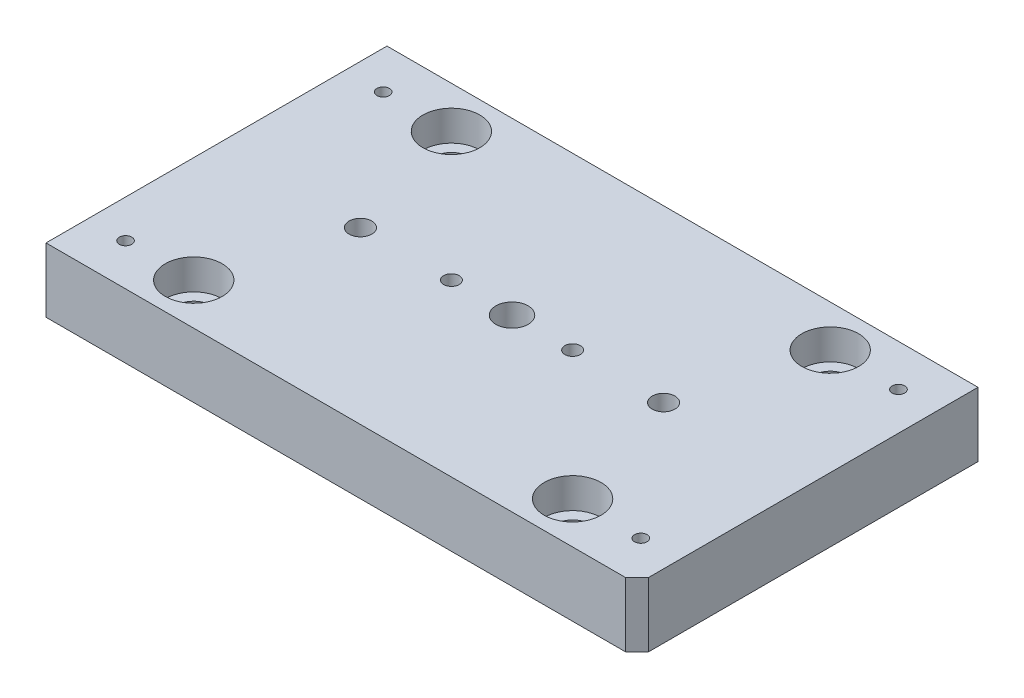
SolidWorks part; units mm, degrees
ref_plane "Plan de face" through (0, 0, 0) normal (0, 0, 1) x (1, 0, 0)
ref_plane "Plan de dessus" through (0, 0, 0) normal (0, 1, 0) x (1, 0, 0)
ref_plane "Plan de droite" through (0, 0, 0) normal (1, 0, 0) x (0, 0, -1)
sketch "Esquisse1" plane through (0, 0, 0) normal (0, 1, 0) x (1, 0, 0)
  line L1 (-78, 45) -> (78, 45)
  line L2 (-78, 45) -> (-78, -45)
  line L3 (-78, -45) -> (78, -45)
  line L4 (78, 45) -> (78, -45)
  point P4 (0, 45)
  point P6 (-78, 0)
  dimension "D1" = 156
  dimension "D2" = 90
extrude "Extrusion1" add sketch "Esquisse1" along normal blind 17
hole_wizard "Trou taraudé M4x0.71" positions "Esquisse3" profile "Esquisse2" tap size "M4x0.7" standard "Ansi Métrique"
sketch "Esquisse3" plane through (0, 17, 0) normal (0, 1, 0) x (-1, 0, 0)
  point P0 (-68, 34)
  point P1 (-68, -34)
  point P3 (68, -34)
  point P5 (68, 34)
  dimension "D1" = 34
  dimension "D2" = 68
  dimension "D3" = 136
  dimension "D4" = 68
sketch "Esquisse2" plane through (68, 17, 34) normal (1, 0, 0) x (0, 0, 1)
  line L0 (0, 0) -> (0, 11.0914)
  line L1 (0, 11.0914) -> (1.65, 10.1)
  line L2 (1.65, 10.1) -> (1.65, 0)
  line L5 (1.65, 0) -> (0, 0)
  line L10 (0, 11.0914) -> (-1.65, 10.1) construction
  line L11 (0, -6.35) -> (0, 107.95) construction
  dimension "Diamètre du trou pour taraudage" = 3.3
  dimension "Profondeur du trou pour taraudage" = 10.1
  dimension "Angle de pointe" = 118
hole_wizard "Chambrage pour vis à tête cylindrique à 6 pans creux (ou vis CHC) M81" positions "Esquisse5" profile "Esquisse4" counterbore size "M8" standard "Ansi Métrique"
sketch "Esquisse5" plane through (0, 17, 0) normal (0, 1, 0) x (-1, 0, 0)
  point P0 (-50, 34)
  point P1 (-50, -34)
  point P3 (50, -34)
  point P5 (50, 34)
  dimension "D1" = 34
  dimension "D2" = 68
  dimension "D3" = 50
  dimension "D4" = 100
sketch "Esquisse4" plane through (50, 17, 34) normal (1, 0, 0) x (0, 0, 1)
  line L0 (0, 0) -> (0, 17)
  line L1 (0, 17) -> (4.5, 17)
  line L3 (4.5, 17) -> (4.5, 8)
  line L4 (4.5, 8) -> (7.5, 8)
  line L5 (7.5, 8) -> (7.5, 0)
  line L7 (7.5, 0) -> (0, 0)
  line L11 (0, -6.35) -> (0, 107.95) construction
  dimension "Diamètre du perçage jusqu'au prochain" = 9
  dimension "Profondeur du perçage jusqu'au prochain" = 17
  dimension "Diamètre du chambrage" = 15
  dimension "Profondeur du chambrage" = 8
sketch "Esquisse6" plane through (0, 17, 0) normal (0, 1, 0) x (-1, 0, 0)
  line L0 (0, 0) -> (-83.2416, 0) construction
  circle A1 centre (-16, 0) radius 2.05
  circle A2 centre (16, 0) radius 2.05
  dimension "D1" = 4.1
  dimension "D4" = 16
  dimension "D5" = 16
extrude "Enlèv. mat.-Extru.1" cut sketch "Esquisse6" against normal through all
hole_wizard "Trou taraudé M10x1.51" positions "Esquisse3D1" profile "Esquisse7" tap size "M10x1.5" standard "Ansi Métrique"
sketch3d "Esquisse3D1"
  point P0 (0, 0, 0)
  point P4 (0, 17, 0)
sketch "Esquisse7" plane through (0, 17, 0) normal (1, 0, 0) x (0, 0, 1)
  line L0 (0, 0) -> (0, 17)
  line L1 (0, 17) -> (4.25, 17)
  line L2 (4.25, 17) -> (4.25, 0)
  line L5 (4.25, 0) -> (0, 0)
  line L11 (0, -6.35) -> (0, 107.95) construction
  dimension "Diamètre du trou pour taraudage jusqu'au prochain" = 8.5
  dimension "Profondeur du trou pour taraudage jusqu'au prochain" = 17
sketch "Esquisse8" plane through (0, 0, 0) normal (0, -1, 0) x (1, 0, 0)
  circle A0 centre (16, 0) radius 4.5
  circle A1 centre (-16, 0) radius 4.5
  dimension "D1" = 9
  dimension "D2" = 9
extrude "Enlèv. mat.-Extru.2" cut sketch "Esquisse8" against normal blind 8
sketch "Esquisse9" plane through (0, 0, 0) normal (0, -1, 0) x (1, 0, 0)
  circle A0 centre (0, 0) radius 6.75
  dimension "D1" = 13.5
extrude "Enlèv. mat.-Extru.5" cut sketch "Esquisse9" against normal blind 4
chamfer "Chanfrein_D" distance 3 angle 45 1 edges at (78, 8.5, 45)
sketch "Esquisse10" plane through (0, 0, 0) normal (0, -1, 0) x (1, 0, 0)
  line L0 (0, 0) -> (100.798, 0) construction
  circle A0 centre (40, 0) radius 3
  circle A1 centre (-40, 0) radius 3
  dimension "D1" = 6
  dimension "D2" = 6
  dimension "D3" = 40
  dimension "D4" = 40
extrude "Enlèv. mat.-Extru.6" cut sketch "Esquisse10" against normal through all
